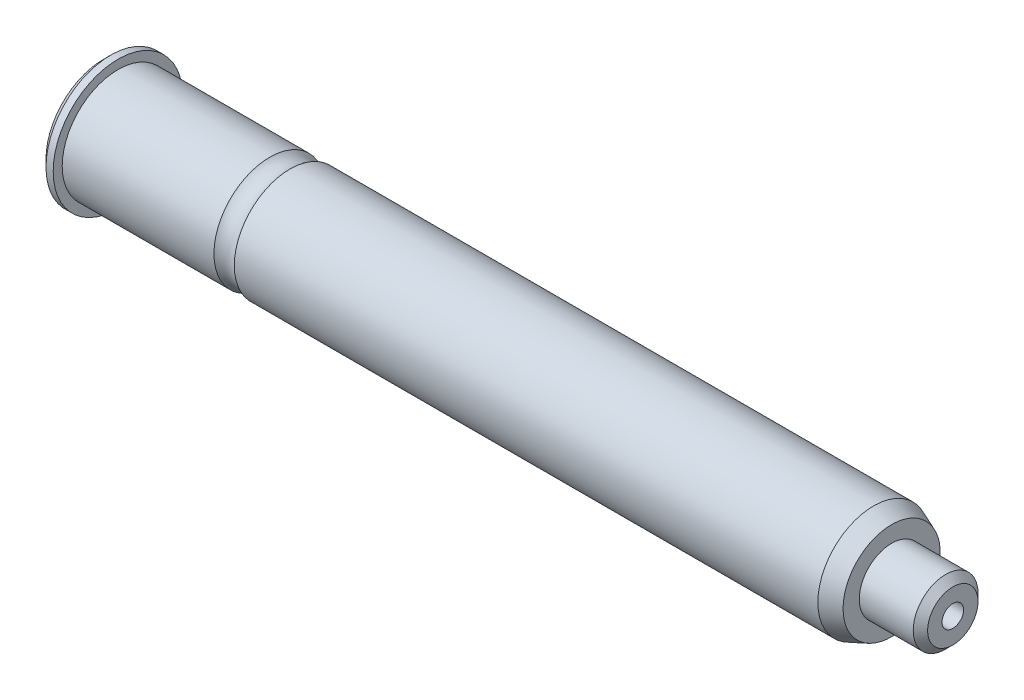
SolidWorks part; units mm, degrees
ref_plane "Plan1" through (0, 0, 0) normal (0, 0, 1) x (1, 0, 0)
ref_plane "Plan2" through (0, 0, 0) normal (0, 1, 0) x (1, 0, 0)
ref_plane "Plan3" through (0, 0, 0) normal (1, 0, 0) x (0, 0, -1)
sketch "Esquisse1" plane through (0, 0, 0) normal (0, 0, 1) x (1, 0, 0)
  line L0 (0, 0) -> (0, -9)
  line L1 (0, -9) -> (2, -9)
  line L2 (2, -9) -> (2, -7.75)
  line L3 (2, -7.75) -> (23.0858, -7.75)
  line L4 (109.5, -6.75) -> (109.5, -4.5)
  line L5 (109.5, -4.5) -> (118, -4.5)
  line L6 (118, -4.5) -> (118, 0)
  line L7 (0, 0) -> (118, 0)
  line L8 (-10, 0) -> (120, 0) construction
  line L9 (109.5, -6.75) -> (107, -7.75)
  line L10 (25.9142, -7.75) -> (107, -7.75)
  arc A0 (25.9142, -7.75) -> (23.0858, -7.75) centre (24.5, -9.5) ccw
  dimension "D9" = 4.5
  dimension "D10" = 9.5
  dimension "D11" = 24.5
  dimension "D1" = 4.5
  dimension "D2" = 7.75
  dimension "D3" = 9
  dimension "D4" = 2
  dimension "D5" = 8.5
  dimension "D6" = 116
  dimension "D7" = 2.5
  dimension "D8" = 1
revolve "Base-Révolution" add sketch "Esquisse1" angle 360 about L8
chamfer "Chanfrein1" distance 1 angle 45 2 edges at (0, 0, 9) (118, 0, 4.5)
hole_wizard "Perçage1" positions "Esquisse3" profile "Esquisse2" legacy
sketch "Esquisse3" plane through (118, 0, 0) normal (1, 0, 0) x (0, 0, -1)
  point P0 (0, 0)
sketch "Esquisse2" plane through (118, 0, 0) normal (0, 1, 0) x (0, 0, -1)
  line L0 (0, 0) -> (0, 25.9013)
  line L1 (0, 25.9013) -> (1.5, 25)
  line L2 (1.5, 25) -> (1.5, 0)
  line L4 (1.5, 0) -> (0, 0)
  line L6 (0, 25.9013) -> (-1.5, 25) construction
  line L7 (0, -4.2442) -> (0, 117.3081) construction
  dimension "Diamètre" = 3
  dimension "Profondeur" = 25
  dimension "Angle" = 118
